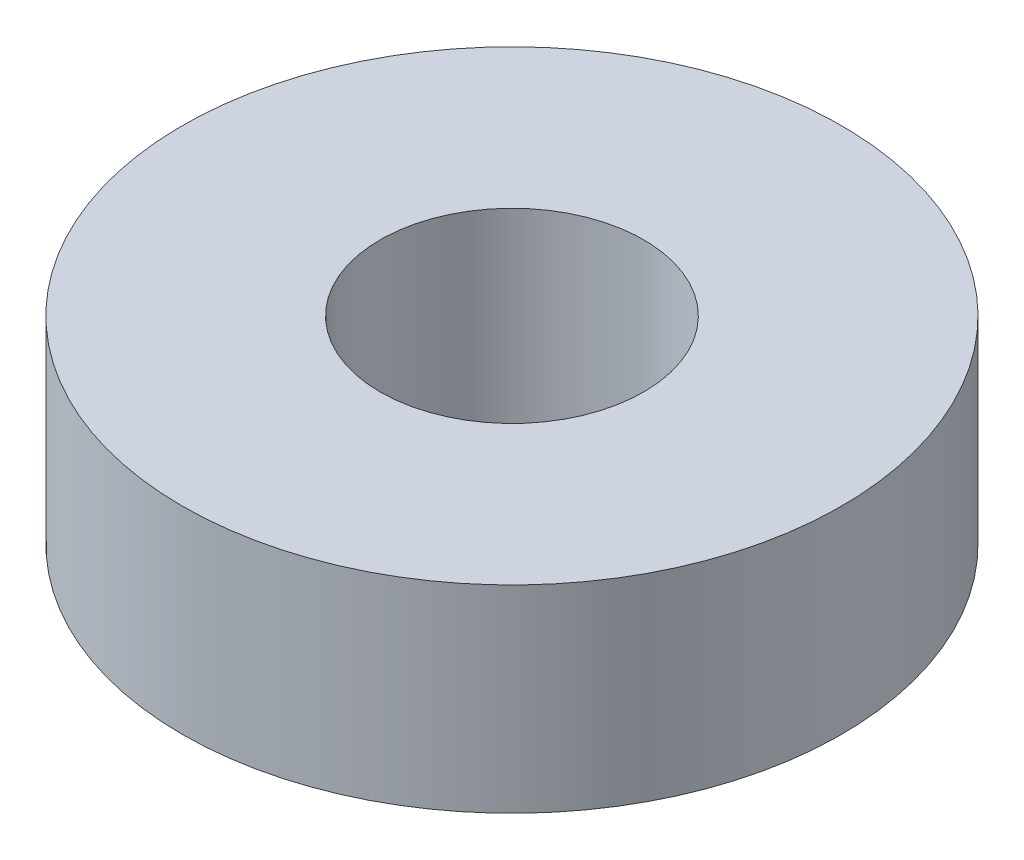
SolidWorks part; units mm, degrees
ref_plane "Front" through (0, 0, 0) normal (0, 0, 1) x (1, 0, 0)
ref_plane "Top" through (0, 0, 0) normal (0, 1, 0) x (1, 0, 0)
ref_plane "Right" through (0, 0, 0) normal (1, 0, 0) x (0, 0, -1)
sketch "Sketch1" plane through (0, 0, 0) normal (0, 1, 0) x (1, 0, 0)
  circle A0 centre (0, 0) radius 4
  circle A1 centre (0, 0) radius 10
extrude "Extrude1" add sketch "Sketch1" along normal blind 6
